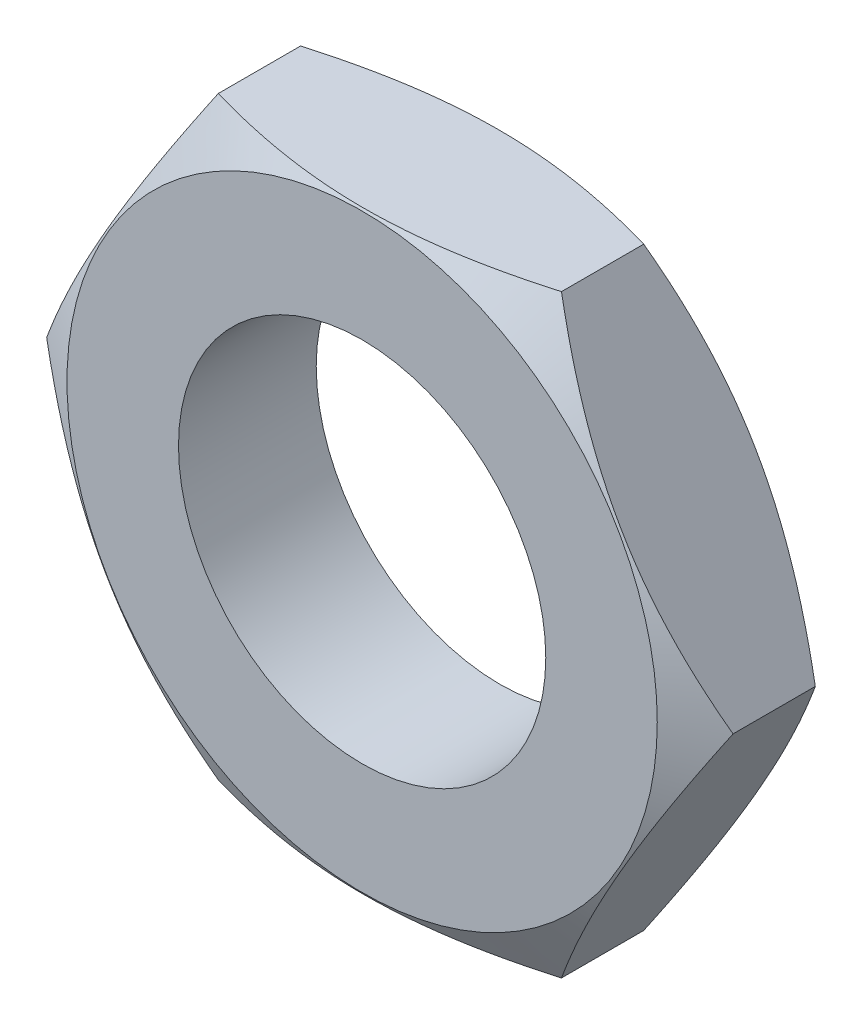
SolidWorks part; units mm, degrees
ref_plane "Plan de face" through (0, 0, 0) normal (0, 0, 1) x (1, 0, 0)
ref_plane "Plan de dessus" through (0, 0, 0) normal (0, 1, 0) x (1, 0, 0)
ref_plane "Plan de droite" through (0, 0, 0) normal (1, 0, 0) x (0, 0, -1)
sketch "Esquisse1" plane through (0, 0, 0) normal (0, 0, 1) x (1, 0, 0)
  circle A0 centre (0, 0) radius 7.475
  circle A1 centre (0, 0) radius 4
  dimension "D1" = 14.95
  dimension "D2" = 8
extrude "Boss.-Extru.1" add sketch "Esquisse1" along normal blind 3
chamfer "Chanfrein1" distance 1.0465 angle 30 2 edges at (7.475, 0, 0) (7.475, 0, 3)
sketch "Esquisse2" plane through (0, 0, 3) normal (0, 0, 1) x (1, 0, 0)
  line L1 (7.475, 0) -> (3.7375, 6.4735)
  line L2 (3.7375, 6.4735) -> (-3.7375, 6.4735)
  line L3 (-3.7375, 6.4735) -> (-7.475, 0)
  line L4 (-7.475, 0) -> (-3.7375, -6.4735)
  line L5 (-3.7375, -6.4735) -> (3.7375, -6.4735)
  line L6 (3.7375, -6.4735) -> (7.475, 0)
  circle A0 centre (0, 0) radius 6.4735 construction
  circle A1 centre (0, 0) radius 7.475 construction
extrude "Enlèv. mat.-Extru.1" cut sketch "Esquisse2" against normal through all flip side to cut
